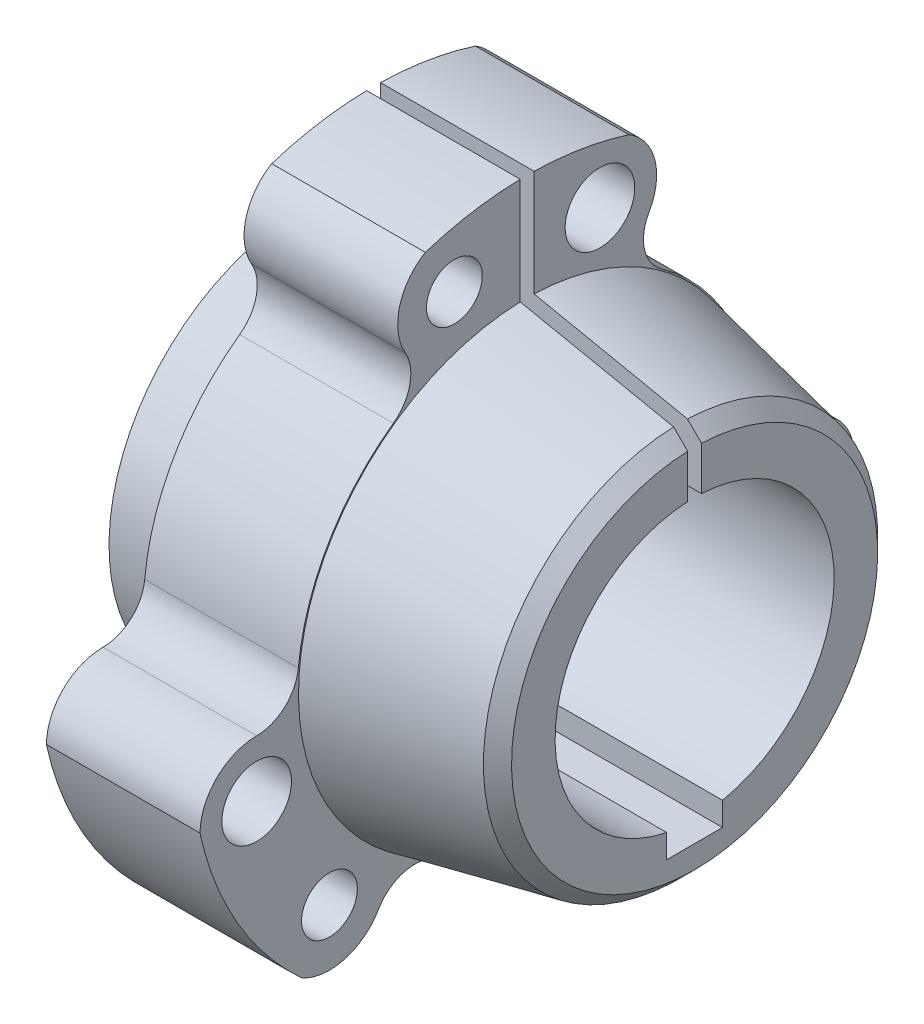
SolidWorks part; units mm, degrees
ref_plane "Front Plane" through (0, 0, 0) normal (0, 0, 1) x (1, 0, 0)
ref_plane "Top Plane" through (0, 0, 0) normal (0, 1, 0) x (1, 0, 0)
ref_plane "Right Plane" through (0, 0, 0) normal (1, 0, 0) x (0, 0, -1)
sketch "Sketch1" plane through (0, 0, 0) normal (0, 0, 1) x (1, 0, 0)
  line L0 (0, 0) -> (80.7025, 0) construction
  line L1 (-7.9248, 15.875) -> (36.5252, 15.875)
  line L2 (36.5252, 15.875) -> (36.5252, 22.098)
  line L4 (17.4752, 26.0161) -> (17.4752, 38.1)
  line L5 (17.4752, 38.1) -> (0, 38.1)
  line L6 (0, 38.1) -> (0, 22.1742)
  line L7 (0, 22.1742) -> (-7.9248, 22.1742)
  line L8 (-7.9248, 22.1742) -> (-7.9248, 15.875)
  line L9 (17.4752, 26.0161) -> (36.5252, 22.098)
  dimension "D1" = 31.75
  dimension "D2" = 44.3484
  dimension "D3" = 44.45
  dimension "D4" = 17.4752
  dimension "D5" = 7.9248
  dimension "D6" = 76.2
  dimension "D7" = 44.196
  dimension "D8" = 52.0321
revolve "Revolve1" add sketch "Sketch1" angle 360 about L0
sketch "Sketch2" plane through (0, 0, 0) normal (1, 0, 0) x (0, 0, -1)
  line L0 (0, 0) -> (0, 49.3524) construction
  line L1 (0, 0) -> (8.2804, 30.7565) construction
  line L2 (0, 0) -> (-8.2804, 30.7565) construction
  line L3 (0, 0) -> (30.7761, -8.2072) construction
  line L4 (0, 0) -> (22.4957, -22.5493) construction
  line L5 (0, 0) -> (-22.4957, -22.5493) construction
  line L6 (0, 0) -> (-30.7761, -8.2072) construction
  line L7 (0, 0) -> (43.3682, -25.0386) construction
  line L8 (0, 0) -> (-43.0282, -24.8423) construction
  circle A0 centre (8.2804, 30.7565) radius 3.9624
  circle A1 centre (22.4957, -22.5493) radius 3.9624
  circle A2 centre (-30.7761, -8.2072) radius 3.9624
  circle A3 centre (-8.2804, 30.7565) radius 3.175
  circle A4 centre (-22.4957, -22.5493) radius 3.175
  circle A5 centre (30.7761, -8.2072) radius 3.175
  circle A6 centre (0, 0) radius 31.8516 construction
  dimension "D6" = 7.9248
  dimension "D9" = 6.35
  dimension "D7" = 63.7032
  dimension "D1" = 120
  dimension "D2" = 120
  dimension "D3" = 16.5608
  dimension "D4" = 16.5608
  dimension "D5" = 16.5608
  dimension "D8" = 55.1686
  dimension "D10" = 55.1686
extrude "Cut-Extrude1" cut sketch "Sketch2" along normal blind 50.8
sketch "Sketch3" plane through (0, 0, 0) normal (1, 0, 0) x (0, 0, -1)
  line L0 (0, 0) -> (41.3664, 23.8829) construction
  line L1 (0, 0) -> (0, 50.9284) construction
  line L2 (0, 0) -> (46.2493, -26.7021) construction
  arc A0 (15.23, 21.272) -> (26.0371, 2.5535) centre (0, 0) cw
  arc A1 (13.8715, 27.5373) -> (9.9576, 36.9862) centre (8.2804, 30.7565) ccw
  arc A2 (37.0098, -9.8696) -> (30.7838, -1.7556) centre (30.7761, -8.2072) ccw
  arc A3 (37.0098, -9.8696) -> (9.9576, 36.9862) centre (0, 0) ccw
  arc A4 (26.0371, 2.5535) -> (30.7838, -1.7556) centre (30.7895, 3.0196) ccw
  arc A5 (15.23, 21.272) -> (13.8715, 27.5373) centre (18.0098, 25.1547) cw
  dimension "D2" = 26.162
  dimension "D4" = 12.9032
  dimension "D5" = 4.7752
  dimension "D1" = 60
  dimension "D3" = 60
extrude "Cut-Extrude2" cut sketch "Sketch3" along normal blind 50.8
pattern_circular "CirPattern1" count 3 over 360 about axis through (0, 0, 0) along (1, 0, 0) of "Cut-Extrude2"
sketch "Sketch4" plane through (0, 0, 0) normal (1, 0, 0) x (0, 0, -1)
  line L0 (0, 0) -> (0, 49.5659)
extrude "Cut-Extrude-Thin1" cut sketch "Sketch4" against normal through all and the other way through all thin
sketch "Sketch5" plane through (0, 0, 0) normal (1, 0, 0) x (0, 0, -1)
  line L0 (-3.175, -13.1572) -> (-3.175, -18.2372)
  line L1 (-3.175, -18.2372) -> (3.175, -18.2372)
  line L2 (3.175, -18.2372) -> (3.175, -13.1572)
  line L3 (3.175, -13.1572) -> (-3.175, -13.1572)
  line L4 (0, 0) -> (0, -14.9045) construction
  dimension "D1" = 6.35
  dimension "D2" = 5.08
  dimension "D3" = 18.2372
extrude "Cut-Extrude3" cut sketch "Sketch5" against normal mid plane 76.2
chamfer "Chamfer1" distance 1.27 angle 45 1 edges at (36.5252, -22.098, 0)
